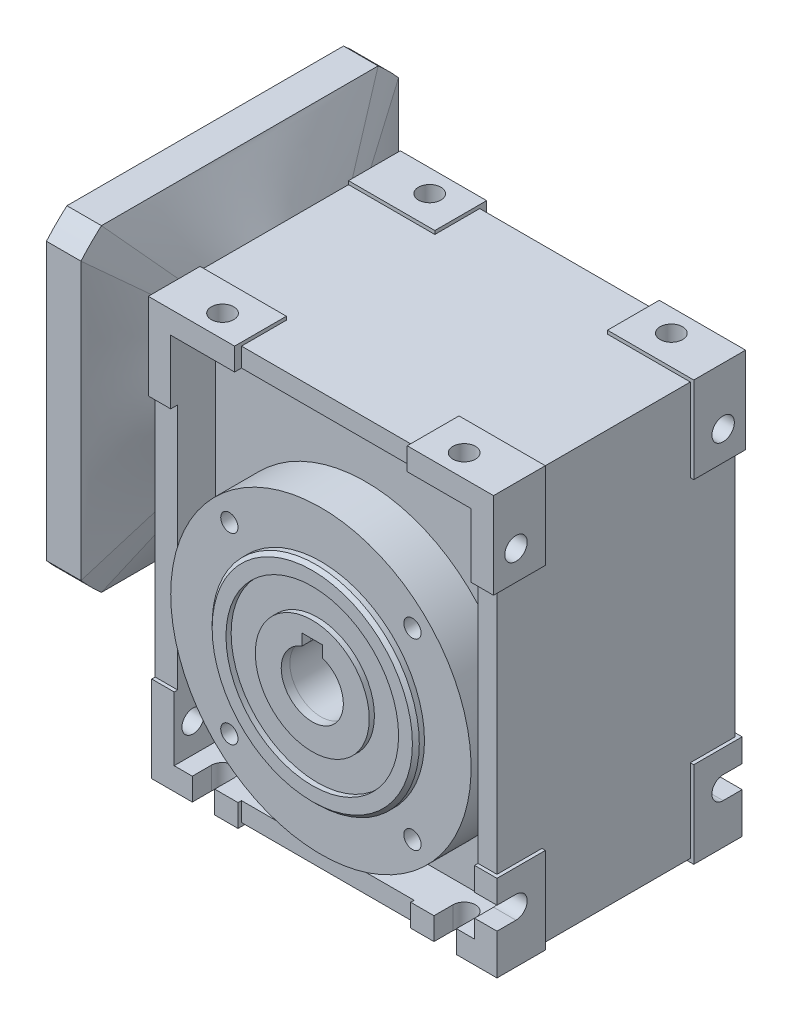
SolidWorks part; units mm, degrees
ref_plane "前视基准面" through (0, 0, 0) normal (0, 0, 1) x (1, 0, 0)
ref_plane "上视基准面" through (0, 0, 0) normal (0, 1, 0) x (1, 0, 0)
ref_plane "右视基准面" through (0, 0, 0) normal (1, 0, 0) x (0, 0, -1)
sketch "草图1" plane through (0, 0, 0) normal (1, 0, 0) x (0, 0, -1)
  line L0 (36.5, 71.5) -> (21.5, 71.5)
  line L1 (-35.5, -50) -> (-21.5, -50)
  line L2 (35.5, -25) -> (34.5, -25)
  line L3 (34.5, -25) -> (34.5, 46.5)
  line L4 (-35.5, -25) -> (-34.5, -25)
  line L5 (-36.5, 71.5) -> (-36.5, 46.5)
  line L6 (35.5, -50) -> (35.5, -25)
  line L7 (35.5, -25) -> (34.5, -25)
  line L8 (-34.5, -25) -> (-34.5, 46.5)
  line L9 (21.5, -49) -> (-21.5, -49)
  line L10 (36.5, 71.5) -> (36.5, 46.5)
  line L11 (36.5, 46.5) -> (34.5, 46.5)
  line L12 (21.5, 70.5) -> (-21.5, 70.5)
  line L13 (21.5, -50) -> (35.5, -50)
  line L14 (-34.5, -25) -> (-35.5, -25)
  line L15 (-35.5, -25) -> (-35.5, -50)
  line L16 (21.5, -50) -> (21.5, -49)
  line L17 (-36.5, 46.5) -> (-34.5, 46.5)
  line L18 (-21.5, 71.5) -> (-36.5, 71.5)
  line L19 (-21.5, -49) -> (-21.5, -50)
  line L20 (21.5, 71.5) -> (21.5, 70.5)
  line L21 (-21.5, 70.5) -> (-21.5, 71.5)
extrude "凸台-拉伸1" add sketch "草图1" along normal blind 100 contours L12 L21 L18 L5 L17 L8 L4 L15 L1 L19 L9 L16 L13 L6 L2 L3 L11 L10 L0 L20
sketch "草图2" plane through (0, 0, 36.5) normal (0, 0, 1) x (1, 0, 0)
  line L0 (25, 71.5) -> (25, 70.5)
  line L1 (100, 71.5) -> (0, 71.5) construction
  line L2 (25, 71.5) -> (75, 71.5)
  line L3 (25, 70.5) -> (75, 70.5)
  line L4 (75, 70.5) -> (75, 71.5)
  line L5 (25, -50) -> (25, -49)
  line L6 (100, -50) -> (0, -50) construction
  line L7 (25, -50) -> (75, -50)
  line L8 (75, -50) -> (75, -49)
  line L9 (75, -49) -> (25, -49)
extrude "切除-拉伸1" cut sketch "草图2" against normal blind 73
sketch "草图3" plane through (0, 70.5, 0) normal (0, 1, 0) x (1, 0, 0)
  line L0 (25, 36.5) -> (75, 36.5)
  line L1 (75, 36.5) -> (75, 34.5)
  line L3 (25, 36.5) -> (25, 34.5)
  line L4 (25, 34.5) -> (75, 34.5)
  line L5 (25, -36.5) -> (75, -36.5)
  line L6 (75, -36.5) -> (75, -34.5)
  line L7 (75, -21.5) -> (75, -36.5) construction
  line L8 (25, -34.5) -> (75, -34.5)
  line L9 (25, -21.5) -> (25, -36.5) construction
  line L10 (25, -34.5) -> (25, -36.5)
  line L11 (75, 36.5) -> (75, 21.5) construction
extrude "切除-拉伸2" cut sketch "草图3" against normal blind 121.5
sketch "草图4" plane through (0, 0, 36.5) normal (0, 0, 1) x (1, 0, 0)
  line L4 (6.5, -43.5) -> (93.5, -43.5)
  line L5 (6.5, -43.5) -> (6.5, 65)
  line L6 (6.5, 65) -> (93.5, 65)
  line L7 (93.5, -43.5) -> (93.5, 65)
  line L8 (6.5, -43.5) -> (93.5, 65) construction
  line L9 (6.5, 65) -> (93.5, -43.5) construction
  point P6 (50, 10.75)
extrude "切除-拉伸3" cut sketch "草图4" against normal blind 13
sketch "草图5" plane through (0, 0, -36.5) normal (0, 0, -1) x (-1, 0, 0)
  line L4 (-93.5, -43.5) -> (-6.5, -43.5)
  line L5 (-93.5, -43.5) -> (-93.5, 65)
  line L6 (-93.5, 65) -> (-6.5, 65)
  line L7 (-6.5, -43.5) -> (-6.5, 65)
  line L8 (-93.5, -43.5) -> (-6.5, 65) construction
  line L9 (-93.5, 65) -> (-6.5, -43.5) construction
  point P6 (-50, 10.75)
extrude "切除-拉伸4" cut sketch "草图5" against normal blind 13 contours L6 L7 L4 L5
sketch "草图6" plane through (0, 70.5, 0) normal (0, 1, 0) x (1, 0, 0)
  line L0 (0, 21.5) -> (0, -21.5)
  line L1 (0, -21.5) -> (1, -21.5)
  line L2 (25, -21.5) -> (0, -21.5) construction
  line L3 (1, -21.5) -> (1, 21.5)
  line L4 (25, 21.5) -> (0, 21.5) construction
  line L5 (1, 21.5) -> (0, 21.5)
  line L6 (100, 21.5) -> (100, -21.5)
  line L7 (100, -21.5) -> (99, -21.5)
  line L8 (100, -21.5) -> (75, -21.5) construction
  line L9 (99, -21.5) -> (99, 21.5)
  line L10 (100, 21.5) -> (75, 21.5) construction
  line L11 (99, 21.5) -> (100, 21.5)
extrude "切除-拉伸5" cut sketch "草图6" against normal blind 119.5
sketch "草图7" plane through (0, 0, 34.5) normal (0, 0, 1) x (1, 0, 0)
  line L0 (0, 46.5) -> (0, -25)
  line L1 (0, -25) -> (1, -25)
  line L3 (6.5, -25) -> (0, -25) construction
  line L4 (1, -25) -> (1, 46.5)
  line L5 (6.5, 46.5) -> (0, 46.5) construction
  line L6 (1, 46.5) -> (0, 46.5)
  line L7 (100, 46.5) -> (100, -25)
  line L8 (100, -25) -> (99, -25)
  line L9 (100, -25) -> (93.5, -25) construction
  line L10 (99, -25) -> (99, 46.5)
  line L11 (100, 46.5) -> (93.5, 46.5) construction
  line L12 (99, 46.5) -> (100, 46.5)
extrude "切除-拉伸6" cut sketch "草图7" against normal blind 69
sketch "草图9" plane through (1, 0, 0) normal (-1, 0, 0) x (0, 0, 1)
  line L0 (-21.5, 70.5) -> (21.5, 70.5)
  line L1 (21.5, 70.5) -> (21.5, 46.5)
  line L2 (21.5, 46.5) -> (34.5, 46.5)
  line L3 (34.5, 46.5) -> (34.5, -25)
  line L4 (34.5, -25) -> (21.5, -25)
  line L5 (21.5, -25) -> (21.5, -49)
  line L6 (21.5, -49) -> (-21.5, -49)
  line L7 (-21.5, -49) -> (-21.5, -25)
  line L8 (-21.5, -25) -> (-34.5, -25)
  line L9 (-34.5, -25) -> (-34.5, 46.5)
  line L10 (-36.5, 46.5) -> (-21.5, 46.5) construction
  line L11 (-34.5, 46.5) -> (-21.5, 46.5)
  line L12 (-21.5, 46.5) -> (-21.5, 70.5)
extrude "凸台-拉伸2" add sketch "草图9" along normal blind 1
sketch "草图10" plane through (0, 0, 0) normal (-1, 0, 0) x (0, 0, 1)
  circle A0 centre (0, 40) radius 30.5
ref_plane "基准面1" through (-10, 0, 0) normal (1, 0, 0) x (0, 0, -1)
sketch "草图11" plane through (-10, 0, 0) normal (1, 0, 0) x (0, 0, -1)
  line L1 (40.0625, -6) -> (-40.0625, -6)
  line L2 (46, -0.0625) -> (46, 80.0625)
  line L3 (40.0625, 86) -> (-40.0625, 86)
  line L4 (-46, -0.0625) -> (-46, 80.0625)
  arc A0 (46, 80.0625) -> (40.0625, 86) centre (0, 40) ccw
  arc A1 (-40.0625, 86) -> (-46, 80.0625) centre (0, 40) ccw
  arc A2 (-46, -0.0625) -> (-40.0625, -6) centre (0, 40) ccw
  arc A3 (40.0625, -6) -> (46, -0.0625) centre (0, 40) ccw
loft "放样1" add profiles "草图11", "草图10"
sketch "草图12" plane through (-10, 0, 0) normal (-1, 0, 0) x (0, 0, 1)
  line L4 (-40.0625, -6) -> (40.0625, -6)
  line L5 (-46, -0.0625) -> (-46, 80.0625)
  line L6 (-40.0625, 86) -> (40.0625, 86)
  line L7 (46, -0.0625) -> (46, 80.0625)
  arc A0 (46, 80.0625) -> (40.0625, 86) centre (0, 40) ccw
  arc A1 (-40.0625, 86) -> (-46, 80.0625) centre (0, 40) ccw
  arc A2 (-46, -0.0625) -> (-40.0625, -6) centre (0, 40) ccw
  arc A3 (40.0625, -6) -> (46, -0.0625) centre (0, 40) ccw
  point P6 (0, 40)
extrude "凸台-拉伸3" add sketch "草图12" along normal blind 10 separate body
sketch "草图15" plane through (100, 0, 0) normal (1, 0, 0) x (0, 0, -1)
  line L1 (0, 0) -> (0, -35.0001)
  line L2 (-30, -31.7501) -> (-35.5, -31.7501)
  line L4 (-35.5, -25) -> (-35.5, -50) construction
  line L5 (35.5, -31.7501) -> (30, -31.7501)
  line L6 (-35.5, -31.7501) -> (-35.5, -38.2501)
  line L7 (35.5, -50) -> (35.5, -25) construction
  line L8 (-35.5, -38.2501) -> (-30, -38.2501)
  line L9 (35.5, -38.2501) -> (35.5, -31.7501)
  line L10 (30, -38.2501) -> (35.5, -38.2501)
  circle A0 centre (-30, 55) radius 3.25
  circle A1 centre (30, 55) radius 3.25
  arc A2 (-30, -38.2501) -> (-30, -31.7501) centre (-30, -35.0001) ccw
  arc A3 (30, -31.7501) -> (30, -38.2501) centre (30, -35.0001) ccw
extrude "切除-拉伸8" cut sketch "草图15" against normal blind 6.5 contours L8 A2 L2 L6 | L5 A3 L10 L9 | A0 | A1
sketch "草图16" plane through (0, 71.5, 0) normal (0, 1, 0) x (1, 0, 0)
  circle A0 centre (15, 30) radius 3.25
  circle A1 centre (85, 30) radius 3.25
  circle A2 centre (85, -30) radius 3.25
  circle A3 centre (15, -30) radius 3.25
  point P5 (50, 0)
  point P11 (50, 0)
extrude "切除-拉伸9" cut sketch "草图16" against normal blind 6.5
sketch "草图19" plane through (0, -50, 0) normal (0, -1, 0) x (1, 0, 0)
  line L0 (11.75, 30) -> (11.75, 35.5)
  line L1 (25, 35.5) -> (0, 35.5) construction
  line L2 (11.75, 35.5) -> (18.25, 35.5)
  line L3 (100, 35.5) -> (75, 35.5) construction
  line L4 (88.25, 35.5) -> (88.25, 30)
  line L5 (100, -35.5) -> (75, -35.5) construction
  line L6 (88.25, -35.5) -> (81.75, -35.5)
  line L7 (81.75, -35.5) -> (81.75, -30)
  line L8 (81.75, 30) -> (81.75, 35.5)
  line L9 (18.25, 35.5) -> (18.25, 30)
  line L10 (25, -35.5) -> (0, -35.5) construction
  line L11 (18.25, -35.5) -> (11.75, -35.5)
  line L12 (11.75, -35.5) -> (11.75, -30)
  line L13 (18.25, -30) -> (18.25, -35.5)
  line L14 (81.75, 35.5) -> (88.25, 35.5)
  line L15 (88.25, -30) -> (88.25, -35.5)
  arc A0 (11.75, 30) -> (18.25, 30) centre (15, 30) ccw
  arc A1 (81.75, 30) -> (88.25, 30) centre (85, 30) ccw
  arc A2 (88.25, -30) -> (81.75, -30) centre (85, -30) ccw
  arc A3 (18.25, -30) -> (11.75, -30) centre (15, -30) ccw
  point P3 (50, 0)
extrude "切除-拉伸12" cut sketch "草图19" against normal blind 6.5
sketch "草图22" plane through (0, 0, 0) normal (-1, 0, 0) x (0, 0, 1)
  circle A0 centre (-30, -35) radius 3.25
  circle A1 centre (30, -35) radius 3.25
extrude "切除-拉伸13" cut sketch "草图22" against normal blind 6.5
sketch "草图23" plane through (0, 0, 23.5) normal (0, 0, 1) x (1, 0, 0)
  circle A0 centre (50, 0) radius 43.5
extrude "凸台-拉伸6" add sketch "草图23" along normal blind 13 separate body
sketch "草图24" plane through (0, 0, 36.5) normal (0, 0, 1) x (1, 0, 0)
  circle A0 centre (50, 0) radius 30
extrude "凸台-拉伸7" add sketch "草图24" along normal blind 2.5 separate body
sketch "草图25" plane through (0, 0, -23.5) normal (0, 0, -1) x (-1, 0, 0)
  circle A0 centre (-50, 0) radius 43.5
extrude "凸台-拉伸8" add sketch "草图25" along normal blind 13 separate body
sketch "草图26" plane through (0, 0, -36.5) normal (0, 0, -1) x (-1, 0, 0)
  circle A0 centre (-50, 0) radius 30
extrude "凸台-拉伸9" add sketch "草图26" along normal blind 2.5 separate body
chamfer "倒角1" distance 1 angle 45 1 edges at (20, 0, -39)
chamfer "倒角2" distance 1 angle 45 1 edges at (80, 0, 39)
sketch "草图30" plane through (0, 0, 36.5) normal (0, 0, 1) x (1, 0, 0)
  point P8 (23.4835, 26.5165)
  point P11 (76.5165, 26.5165)
  point P14 (76.5165, -26.5165)
  point P15 (23.4835, -26.5165)
hole_wizard "M6 螺纹孔1" positions "3D草图1" profile "草图31" tap size "M6" standard "GB"
sketch3d "3D草图1"
  point P0 (23.4835, 26.5165, 36.5)
  point P3 (76.5165, 26.5165, 36.5)
  point P6 (76.5165, -26.5165, 36.5)
  point P9 (23.4835, -26.5165, 36.5)
sketch "草图31" plane through (23.4835, 26.5165, 36.5) normal (1, 0, 0) x (0, -1, 0)
  line L0 (0, 0) -> (0, 18.5022)
  line L1 (0, 18.5022) -> (2.5, 17)
  line L2 (2.5, 17) -> (2.5, 0)
  line L5 (2.5, 0) -> (0, 0)
  line L10 (0, 18.5022) -> (-2.5, 17) construction
  line L11 (0, -6.35) -> (0, 107.95) construction
  dimension "螺纹孔钻头直径" = 5
  dimension "螺纹孔钻头深度" = 17
  dimension "导头角度" = 118
sketch "草图32" plane through (0, 0, -36.5) normal (0, 0, -1) x (-1, 0, 0)
  point P0 (-76.5165, 26.5165)
  point P1 (-23.4835, 26.5165)
  point P3 (-23.4835, -26.5165)
  point P5 (-76.5165, -26.5165)
hole_wizard "M6 螺纹孔4" positions "3D草图4" profile "草图34" tap size "M6" standard "GB"
sketch3d "3D草图4"
  point P0 (76.5165, 26.5165, -36.5)
  point P3 (23.4835, 26.5165, -36.5)
  point P6 (23.4835, -26.5165, -36.5)
  point P9 (76.5165, -26.5165, -36.5)
sketch "草图34" plane through (76.5165, 26.5165, -36.5) normal (1, 0, 0) x (0, 1, 0)
  line L0 (0, 0) -> (0, 18.5022)
  line L1 (0, 18.5022) -> (2.5, 17)
  line L2 (2.5, 17) -> (2.5, 0)
  line L5 (2.5, 0) -> (0, 0)
  line L10 (0, 18.5022) -> (-2.5, 17) construction
  line L11 (0, -6.35) -> (0, 107.95) construction
  dimension "螺纹孔钻头直径" = 5
  dimension "螺纹孔钻头深度" = 17
  dimension "导头角度" = 118
sketch "草图35" plane through (0, 0, -39) normal (0, 0, -1) x (-1, 0, 0)
  line L2 (-53, 11.8) -> (-53, 8.4853)
  line L4 (-47, 8.4853) -> (-47, 11.8)
  line L5 (-47, 11.8) -> (-53, 11.8)
  arc A0 (-53, 8.4853) -> (-47, 8.4853) centre (-50, 0) ccw
extrude "切除-拉伸14" cut sketch "草图35" against normal blind 78
sketch "草图40" plane through (0, 0, 39) normal (0, 0, 1) x (1, 0, 0)
  circle A0 centre (50, 0) radius 25
  circle A1 centre (50, 0) radius 16.5
extrude "切除-拉伸15" cut sketch "草图40" against normal blind 1.5
sketch "草图41" plane through (0, 0, -39) normal (0, 0, -1) x (-1, 0, 0)
  circle A0 centre (-50, 0) radius 16.5
  circle A1 centre (-50, 0) radius 25
extrude "切除-拉伸16" cut sketch "草图41" against normal blind 1.5
